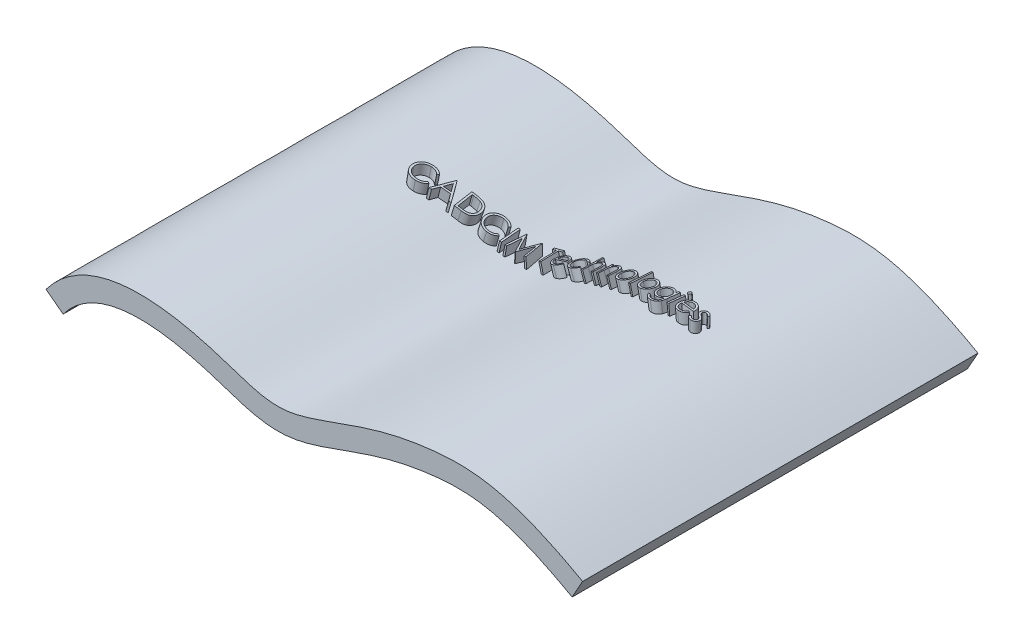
SolidWorks part; units mm, degrees
ref_plane "Front Plane" through (0, 0, 0) normal (0, 0, 1) x (1, 0, 0)
ref_plane "Top Plane" through (0, 0, 0) normal (0, 1, 0) x (1, 0, 0)
ref_plane "Right Plane" through (0, 0, 0) normal (1, 0, 0) x (0, 0, -1)
sketch "Sketch4" plane through (0, 0, 0) normal (0, 0, 1) x (1, 0, 0)
  spline S0 degree 3 poles (-136.283, -7.1344) (-115.5606, 20.3544) (-56.9605, 9.2906) (-25.4556, -6.2929) (9.9523, 12.8161) (59.1091, 20.6253) (80.8874, 18.1539) (113.4582, 0) knots 0 0 0 0 0.324106 0.524606 0.748902 0.796441 1 1 1 1
extrude "Extrude-Thin1" add sketch "Sketch4" along normal mid plane 184 thin
sketch "Sketch5" plane through (0, 0, 0) normal (0, 1, 0) x (1, 0, 0)
  line L0 (-136.283, -92) -> (-136.283, 92) construction
  line L1 (113.4582, -92) -> (113.4582, 92) construction
  arc A0 (-136.283, 0) -> (113.4582, 0) centre (-11.4124, -355.229) cw construction
  text T0 "CADCIM Technologies" font "Century Gothic" height in points 36
wrap "Wrap1" sketch "Sketch5" wrap type emboss source sketch "Sketch5" thickness 5 parameters "D1"=5
